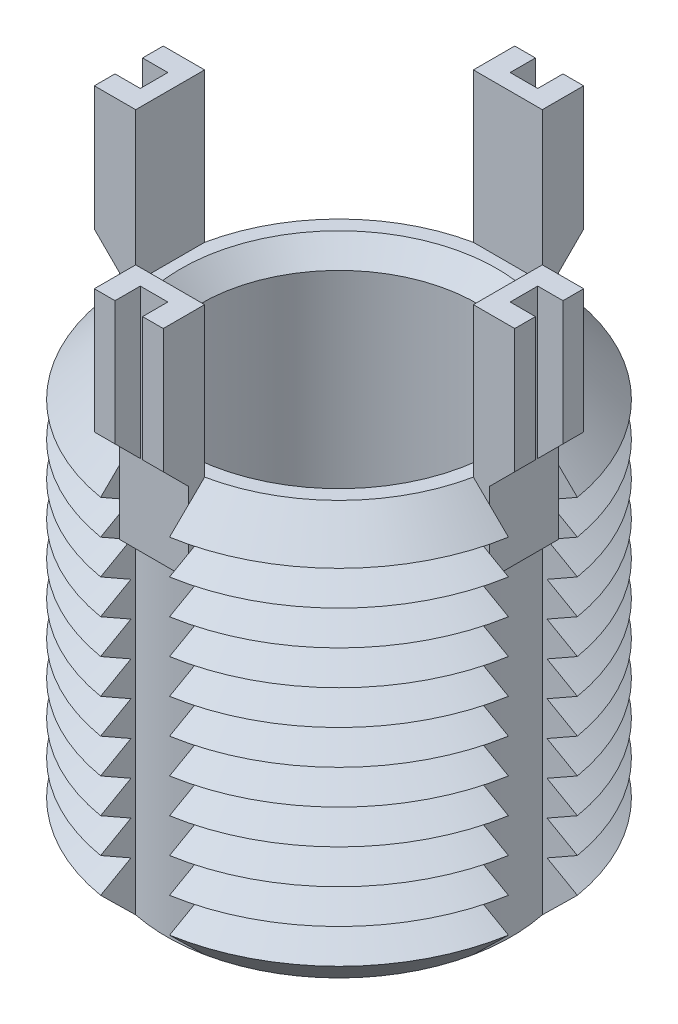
SolidWorks part; units mm, degrees
ref_plane "Front Plane" through (0, 0, 0) normal (0, 0, 1) x (1, 0, 0)
ref_plane "Top Plane" through (0, 0, 0) normal (0, 1, 0) x (1, 0, 0)
ref_plane "Right Plane" through (0, 0, 0) normal (1, 0, 0) x (0, 0, -1)
sketch "Sketch1" plane through (0, 0, 0) normal (0, 1, 0) x (1, 0, 0)
  circle A0 centre (0, 0) radius 9
  dimension "D1" = 18
extrude "Boss-Extrude1" add sketch "Sketch1" against normal blind 18
chamfer "Chamfer1" distance 1.5 angle 45 2 edges at (0, -18, 9) (0, 0, 9)
sketch "Sketch2" plane through (0, 0, 0) normal (1, 0, 0) x (0, 0, -1)
  line L0 (0, 0.8859) -> (0, -9.2617) construction
sketch "Sketch3" plane through (0, 0, 0) normal (1, 0, 0) x (0, 0, -1)
  line L0 (-9, -1.5) -> (-7.701, -2.25)
  line L1 (-7.701, -2.25) -> (-9, -3)
  line L2 (-9, -1.5) -> (-9, -16.5) construction
  line L3 (-9, -3) -> (-9, -1.5)
  dimension "D1" = 1.5
revolve "Cut-Revolve1" cut sketch "Sketch3" angle 360 about L0
pattern_linear "LPattern1" count 10 spacing 1.5 along (0, -1, 0) of "Cut-Revolve1"
sketch "Sketch4" plane through (0, 0, 0) normal (0, 1, 0) x (1, 0, 0)
  line L0 (-7.3485, 1.5) -> (-8.8741, 1.5)
  line L2 (-8.8741, -1.5) -> (-7.3485, -1.5)
  arc A0 (-7.3485, 1.5) -> (-7.3485, -1.5) centre (0, 0) ccw
  arc A1 (-8.8741, 1.5) -> (-8.8741, -1.5) centre (0, 0) ccw
  circle A2 centre (0, 0) radius 9 construction
  circle A3 centre (0, 0) radius 7.5 construction
  point P1 (-7.5, 0)
  point P3 (-9, 0)
  point P13 (0, 0)
  dimension "D1" = 3
extrude "Cut-Extrude1" cut sketch "Sketch4" against normal up to surface (18 mm away)
pattern_circular "CirPattern1" count 4 over 360 about axis through (0, 0, 0) along (0, 1, 0) of "Cut-Extrude1"
sketch "Sketch5" plane through (0, 0, 0) normal (1, 0, 0) x (0, 0, -1)
  line L0 (-7.3485, 6.5) -> (-7.3485, -3.5)
  line L1 (-7.3485, -3.5) -> (-8.0485, -3.5)
  line L2 (-8.0485, -3.5) -> (-8.0485, 0)
  line L3 (-8.0485, 0) -> (-9.1485, 1.1)
  line L4 (-9.1485, 1.1) -> (-9.1485, 6.5)
  line L5 (-9.1485, 6.5) -> (-7.3485, 6.5)
  line L6 (-8.8741, -4.5) -> (-1.5, -4.5) construction
  point P9 (-1.5, 0)
  point P10 (-8.0485, 0)
  dimension "D1" = 1
  dimension "D2" = 10
  dimension "D3" = 6.5
  dimension "D4" = 1.8
  dimension "D5" = 0.7
  dimension "D6" = 45
extrude "Boss-Extrude3" add sketch "Sketch5" along normal mid plane 3
pattern_circular "CirPattern2" count 4 over 360 about axis through (0, 0, 0) along (0, 1, 0) of "Boss-Extrude3"
sketch "Sketch6" plane through (0, 6.5, 0) normal (0, 1, 0) x (1, 0, 0)
  line L0 (-9.1485, -1.5) -> (-9.1485, 1.5) construction
  line L1 (-9.1485, -0.6) -> (-8.0485, -0.6)
  line L2 (-9.1485, -0.6) -> (-9.1485, 0.6)
  line L3 (-9.1485, 0.6) -> (-8.0485, 0.6)
  line L4 (-8.0485, -0.6) -> (-8.0485, 0.6)
  line L5 (-9.1485, -0.6) -> (-8.0485, 0.6) construction
  line L6 (-9.1485, 0.6) -> (-8.0485, -0.6) construction
  line L7 (9.1485, 1.5) -> (9.1485, -1.5) construction
  line L8 (-0.6, 8.0485) -> (0.6, 8.0485)
  line L9 (-0.6, 8.0485) -> (-0.6, 9.1485)
  line L10 (-0.6, 9.1485) -> (0.6, 9.1485)
  line L11 (0.6, 8.0485) -> (0.6, 9.1485)
  line L12 (-0.6, 8.0485) -> (0.6, 9.1485) construction
  line L13 (-0.6, 9.1485) -> (0.6, 8.0485) construction
  line L14 (8.0485, -0.6) -> (9.1485, -0.6)
  line L15 (8.0485, -0.6) -> (8.0485, 0.6)
  line L16 (8.0485, 0.6) -> (9.1485, 0.6)
  line L17 (9.1485, -0.6) -> (9.1485, 0.6)
  line L18 (8.0485, -0.6) -> (9.1485, 0.6) construction
  line L19 (8.0485, 0.6) -> (9.1485, -0.6) construction
  line L20 (-0.6, -9.1485) -> (0.6, -9.1485)
  line L21 (-0.6, -9.1485) -> (-0.6, -8.0485)
  line L22 (-0.6, -8.0485) -> (0.6, -8.0485)
  line L23 (0.6, -9.1485) -> (0.6, -8.0485)
  line L24 (-0.6, -9.1485) -> (0.6, -8.0485) construction
  line L25 (-0.6, -8.0485) -> (0.6, -9.1485) construction
  line L26 (-1.5, 9.1485) -> (1.5, 9.1485) construction
  line L27 (1.5, -9.1485) -> (-1.5, -9.1485) construction
  point P0 (-8.5985, 0)
  point P7 (-9.1485, 0)
  point P8 (-9.1485, 0)
  point P9 (0, 8.5985)
  point P14 (8.5985, 0)
  point P19 (0, -8.5985)
  point P24 (0, 9.1485)
  point P25 (9.1485, 0)
  point P26 (9.1485, 0)
  point P27 (0, 9.1485)
  point P30 (0, -9.1485)
  point P33 (0, -9.1485)
  dimension "D1" = 1.2
  dimension "D2" = 1.1
extrude "Cut-Extrude3" cut sketch "Sketch6" against normal through all both and the other way through all
sketch "Sketch7" plane through (0, 0, 0) normal (0, 1, 0) x (1, 0, 0)
  circle A0 centre (0, 0) radius 6
  dimension "D1" = 12
extrude "Cut-Extrude4" cut sketch "Sketch7" against normal up to surface (18 mm away)
chamfer "Chamfer2" distance 0.875 angle 45 2 edges at (0, 0, 6) (0, -18, 6)
